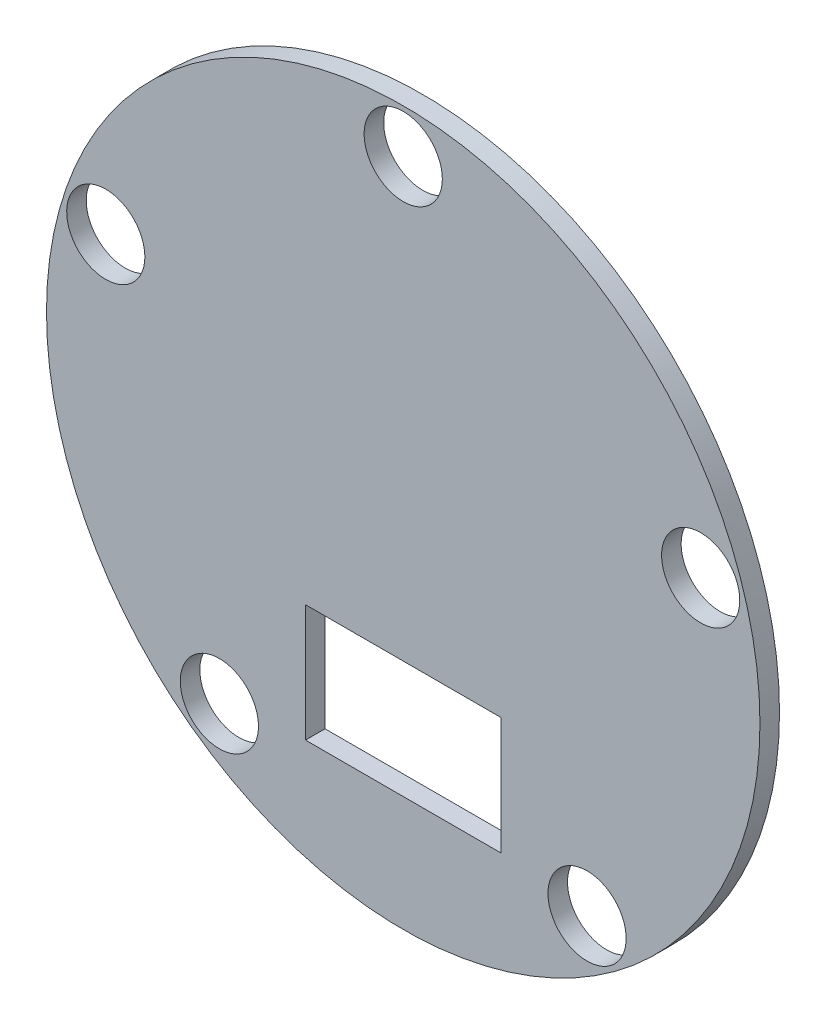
SolidWorks part; units mm, degrees
ref_plane "Front Plane" through (0, 0, 0) normal (0, 0, 1) x (1, 0, 0)
ref_plane "Top Plane" through (0, 0, 0) normal (0, 1, 0) x (1, 0, 0)
ref_plane "Right Plane" through (0, 0, 0) normal (1, 0, 0) x (0, 0, -1)
sketch "Sketch1" plane through (0, 0, 0) normal (0, 0, 1) x (1, 0, 0)
  circle A0 centre (0, 0) radius 115.8875
  dimension "D1" = 231.775
extrude "Boss-Extrude1" add sketch "Sketch1" along normal blind 6.35
sketch "Sketch2" plane through (0, 0, 6.35) normal (0, 0, 1) x (1, 0, 0)
  line L0 (0, 0) -> (0, 101.6) construction
  circle A0 centre (0, 101.6) radius 12.7
  circle A2 centre (0, 0) radius 115.8875 construction
  dimension "D1" = 25.4
  dimension "D2" = 101.6
extrude "Cut-Extrude1" cut sketch "Sketch2" against normal through all
pattern_circular "CirPattern1" count 5 over 360 about axis through (0, 0, 0) along (0, 0, 1) of "Cut-Extrude1"
sketch "Sketch5" plane through (0, 0, 6.35) normal (0, 0, 1) x (1, 0, 0)
  line L1 (-31.75, -40.3542) -> (31.75, -40.3542)
  line L2 (-31.75, -40.3542) -> (-31.75, -78.4542)
  line L3 (-31.75, -78.4542) -> (31.75, -78.4542)
  line L4 (31.75, -40.3542) -> (31.75, -78.4542)
  arc A0 (17.8451, -51.4985) -> (-17.8451, -51.4985) centre (0, -14.986) ccw construction
  dimension "D1" = 38.1
  dimension "D2" = 63.5
  dimension "D3" = 31.75
extrude "Cut-Extrude2" cut sketch "Sketch5" against normal through all
